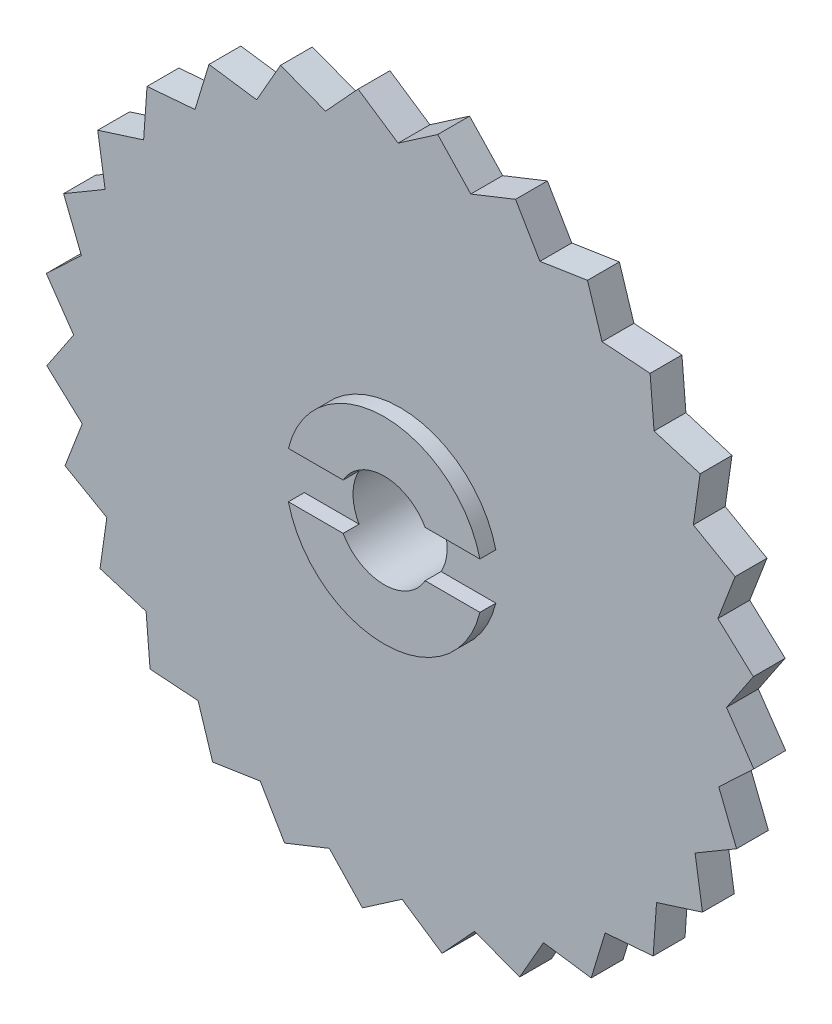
SolidWorks part; units mm, degrees
ref_plane "Plan de face" through (0, 0, 0) normal (0, 0, 1) x (1, 0, 0)
ref_plane "Plan de dessus" through (0, 0, 0) normal (0, 1, 0) x (1, 0, 0)
ref_plane "Plan de droite" through (0, 0, 0) normal (1, 0, 0) x (0, 0, -1)
sketch "Esquisse1" plane through (0, 0, 0) normal (0, 0, 1) x (1, 0, 0)
  circle A0 centre (0, 0) radius 22.34
  dimension "D1" = 44.68
extrude "Extrusion1" add sketch "Esquisse1" along normal blind 9
sketch "Esquisse2" plane through (0, 0, 9) normal (0, 0, 1) x (1, 0, 0)
  circle A0 centre (0, 0) radius 6.185
  circle A1 centre (0, 0) radius 22.34
  dimension "D1" = 12.37
  dimension "D2" = 44.68
extrude "Enlèv. mat.-Extru.1" cut sketch "Esquisse2" against normal blind 1
sketch "Esquisse3" plane through (0, 0, 9) normal (0, 0, 1) x (1, 0, 0)
  circle A0 centre (0, 0) radius 2.955
  dimension "D1" = 5.91
extrude "Enlèv. mat.-Extru.2" cut sketch "Esquisse3" against normal through all
sketch "Esquisse4" plane through (0, 0, 0) normal (0, 0, -1) x (-1, 0, 0)
  circle A0 centre (0, 0) radius 8.5
  circle A1 centre (0, 0) radius 22.34
  dimension "D1" = 17
  dimension "D2" = 44.68
extrude "Enlèv. mat.-Extru.3" cut sketch "Esquisse4" against normal blind 6
sketch "Esquisse5" plane through (0, 0, 0) normal (0, 0, -1) x (-1, 0, 0)
  circle A0 centre (0, 0) radius 6.975
  circle A2 centre (0, 0) radius 8.5
  dimension "D1" = 17
  dimension "D2" = 13.95
extrude "Enlèv. mat.-Extru.4" cut sketch "Esquisse5" against normal blind 1
sketch "Esquisse6" plane through (0, 0, 1) normal (0, 0, -1) x (-1, 0, 0)
  circle A0 centre (0, 0) radius 5.97
  circle A1 centre (0, 0) radius 8.5
  dimension "D1" = 11.94
  dimension "D2" = 17
extrude "Enlèv. mat.-Extru.5" cut sketch "Esquisse6" against normal blind 3.22
sketch "Esquisse7" plane through (0, 0, 4.22) normal (0, 0, -1) x (-1, 0, 0)
  circle A0 centre (0, 0) radius 6.96
  circle A1 centre (0, 0) radius 8.5
  dimension "D1" = 13.92
  dimension "D2" = 17
extrude "Enlèv. mat.-Extru.6" cut sketch "Esquisse7" against normal blind 1.78
sketch "Esquisse9" plane through (0, 0, 8) normal (0, 0, 1) x (1, 0, 0)
  line L0 (-22.184, -2.6357) -> (0, 0) construction
  line L1 (0, 0) -> (-22.2143, 2.3668) construction
  line L2 (0, 0) -> (-22.3396, -0.1353)
  line L3 (-19.3801, -2.3026) -> (-19.3933, -0.1175) construction
  line L4 (-19.3933, -0.1175) -> (-19.4065, 2.0676) construction
  line L5 (-22.184, -2.6357) -> (-20.4996, -0.1242)
  line L6 (-20.4996, -0.1242) -> (-22.2143, 2.3668)
  line L7 (-22.184, -2.6357) -> (-19.958, -4.6827)
  line L8 (-19.958, -4.6827) -> (-21.0413, -7.506)
  line L9 (0, 0) -> (-21.0413, -7.506) construction
  line L10 (-15.9498, -12.8784) -> (-15.7008, -15.8922)
  line L11 (-18.8435, -12) -> (-15.9498, -12.8784)
  line L12 (-18.8435, -12) -> (-18.4156, -9.0063)
  line L13 (-18.4156, -9.0063) -> (-21.0413, -7.506)
  line L14 (0, 0) -> (-15.7008, -15.8922) construction
  line L15 (-12.6842, -16.1047) -> (-15.7008, -15.8922)
  line L16 (-11.7708, -18.9875) -> (-12.6842, -16.1047)
  line L17 (-11.7708, -18.9875) -> (-8.7826, -18.5234)
  line L18 (-8.7826, -18.5234) -> (-7.2506, -21.1307)
  line L19 (-4.4405, -20.0133) -> (-7.2506, -21.1307)
  line L20 (-2.3668, -22.2143) -> (-4.4405, -20.0133)
  line L21 (-2.3668, -22.2143) -> (0.1242, -20.4996)
  line L22 (0.1242, -20.4996) -> (2.6357, -22.184)
  line L23 (0, 0) -> (2.6357, -22.184) construction
  line L24 (4.6827, -19.958) -> (2.6357, -22.184)
  line L25 (7.506, -21.0413) -> (4.6827, -19.958)
  line L26 (7.506, -21.0413) -> (9.0063, -18.4156)
  line L27 (9.0063, -18.4156) -> (12, -18.8435)
  line L28 (12.8784, -15.9498) -> (12, -18.8435)
  line L29 (15.8922, -15.7008) -> (12.8784, -15.9498)
  line L30 (15.8922, -15.7008) -> (16.1047, -12.6842)
  line L31 (16.1047, -12.6842) -> (18.9875, -11.7708)
  line L32 (18.5234, -8.7826) -> (18.9875, -11.7708)
  line L33 (21.1307, -7.2506) -> (18.5234, -8.7826)
  line L34 (21.1307, -7.2506) -> (20.0133, -4.4405)
  line L35 (20.0133, -4.4405) -> (22.2143, -2.3668)
  line L36 (20.4996, 0.1242) -> (22.2143, -2.3668)
  line L37 (22.184, 2.6357) -> (20.4996, 0.1242)
  line L38 (22.184, 2.6357) -> (19.958, 4.6827)
  line L39 (19.958, 4.6827) -> (21.0413, 7.506)
  line L40 (-7.506, 21.0413) -> (-9.0063, 18.4156)
  line L41 (-9.0063, 18.4156) -> (-12, 18.8435)
  line L42 (-12.8784, 15.9498) -> (-12, 18.8435)
  line L43 (-15.8922, 15.7008) -> (-12.8784, 15.9498)
  line L44 (-15.8922, 15.7008) -> (-16.1047, 12.6842)
  line L45 (-16.1047, 12.6842) -> (-18.9875, 11.7708)
  line L46 (-18.5234, 8.7826) -> (-18.9875, 11.7708)
  line L47 (-21.1307, 7.2506) -> (-18.5234, 8.7826)
  line L48 (-21.1307, 7.2506) -> (-20.0133, 4.4405)
  line L49 (-20.0133, 4.4405) -> (-22.2143, 2.3668)
  line L50 (21.0413, 7.506) -> (0, 0) construction
  line L51 (-7.506, 21.0413) -> (-4.6827, 19.958)
  line L52 (-4.6827, 19.958) -> (-2.6357, 22.184)
  line L53 (-0.1242, 20.4996) -> (-2.6357, 22.184)
  line L54 (2.3668, 22.2143) -> (-0.1242, 20.4996)
  line L55 (2.3668, 22.2143) -> (4.4405, 20.0133)
  line L56 (4.4405, 20.0133) -> (7.2506, 21.1307)
  line L57 (8.7826, 18.5234) -> (7.2506, 21.1307)
  line L58 (11.7708, 18.9875) -> (8.7826, 18.5234)
  line L59 (11.7708, 18.9875) -> (12.6842, 16.1047)
  line L60 (12.6842, 16.1047) -> (15.7008, 15.8922)
  line L61 (15.9498, 12.8784) -> (15.7008, 15.8922)
  line L62 (18.8435, 12) -> (15.9498, 12.8784)
  line L63 (18.8435, 12) -> (18.4156, 9.0063)
  line L64 (18.4156, 9.0063) -> (21.0413, 7.506)
  circle A0 centre (0, 0) radius 22.34
  circle A1 centre (0, 0) radius 20.5
  arc A2 (-22.2143, 2.3668) -> (-22.184, -2.6357) centre (-20.4996, -0.1242) ccw
  arc A3 (-21.0413, -7.506) -> (-22.184, -2.6357) centre (-19.958, -4.6827) cw
  arc A4 (-15.7008, -15.8922) -> (-18.8435, -12) centre (-15.9498, -12.8784) cw
  arc A5 (-21.0413, -7.506) -> (-18.8435, -12) centre (-18.4156, -9.0063) ccw
  arc A6 (-15.7008, -15.8922) -> (-11.7708, -18.9875) centre (-12.6842, -16.1047) ccw
  arc A7 (-7.2506, -21.1307) -> (-11.7708, -18.9875) centre (-8.7826, -18.5234) cw
  arc A8 (-7.2506, -21.1307) -> (-2.3668, -22.2143) centre (-4.4405, -20.0133) ccw
  arc A9 (2.6357, -22.184) -> (-2.3668, -22.2143) centre (0.1242, -20.4996) cw
  arc A10 (2.6357, -22.184) -> (7.506, -21.0413) centre (4.6827, -19.958) ccw
  arc A11 (12, -18.8435) -> (7.506, -21.0413) centre (9.0063, -18.4156) cw
  arc A12 (12, -18.8435) -> (15.8922, -15.7008) centre (12.8784, -15.9498) ccw
  arc A13 (18.9875, -11.7708) -> (15.8922, -15.7008) centre (16.1047, -12.6842) cw
  arc A14 (18.9875, -11.7708) -> (21.1307, -7.2506) centre (18.5234, -8.7826) ccw
  arc A15 (22.2143, -2.3668) -> (21.1307, -7.2506) centre (20.0133, -4.4405) cw
  arc A16 (22.2143, -2.3668) -> (22.184, 2.6357) centre (20.4996, 0.1242) ccw
  arc A17 (21.0413, 7.506) -> (22.184, 2.6357) centre (19.958, 4.6827) cw
  arc A18 (-12, 18.8435) -> (-7.506, 21.0413) centre (-9.0063, 18.4156) cw
  arc A19 (-12, 18.8435) -> (-15.8922, 15.7008) centre (-12.8784, 15.9498) ccw
  arc A20 (-18.9875, 11.7708) -> (-15.8922, 15.7008) centre (-16.1047, 12.6842) cw
  arc A21 (-18.9875, 11.7708) -> (-21.1307, 7.2506) centre (-18.5234, 8.7826) ccw
  arc A22 (-22.2143, 2.3668) -> (-21.1307, 7.2506) centre (-20.0133, 4.4405) cw
  arc A23 (-2.6357, 22.184) -> (-7.506, 21.0413) centre (-4.6827, 19.958) ccw
  arc A24 (-2.6357, 22.184) -> (2.3668, 22.2143) centre (-0.1242, 20.4996) cw
  arc A25 (7.2506, 21.1307) -> (2.3668, 22.2143) centre (4.4405, 20.0133) ccw
  arc A26 (7.2506, 21.1307) -> (11.7708, 18.9875) centre (8.7826, 18.5234) cw
  arc A27 (15.7008, 15.8922) -> (11.7708, 18.9875) centre (12.6842, 16.1047) ccw
  arc A28 (15.7008, 15.8922) -> (18.8435, 12) centre (15.9498, 12.8784) cw
  arc A29 (21.0413, 7.506) -> (18.8435, 12) centre (18.4156, 9.0063) ccw
  point P9 (-20.4996, -0.1242)
  dimension "D1" = 44.68
  dimension "D2" = 41
  dimension "D3" = 12.857
  dimension "D4" = 1.84
extrude "Enlèv. mat.-Extru.7" cut sketch "Esquisse9" against normal through all contours L12 L13 M2 | L8 L7 M2 | L2 L6 M2 | L5 L2 M2 | L11 L10 M2 | L16 L15 M2 | L18 L17 M2 | L20 L19 M2 | L22 L21 M2 | L25 L24 M2 | L27 L26 M2 | L29 L28 M2 | L31 L30 M2 | L33 L32 M2 | L35 L34 M2 | L37 L36 M2 | L39 L38 M2 | L63 L64 M2 | L62 L61 M2 | L59 L60 M2 | L55 L56 M2 | L58 L57 M2 | L54 L53 M2 | L51 L52 M2 | L41 L40 M2 | L43 L42 M2 | L47 L46 M2 | L45 L44 M2 | L49 L48 M2
sketch "Esquisse13" plane through (0, 0, 9) normal (0, 0, 1) x (1, 0, 0)
  line L0 (-6.185, 0) -> (6.185, 0) construction
  line L1 (6.185, 0) -> (6.185, 1.45)
  line L2 (6.185, 0) -> (6.185, -1.45)
  line L3 (-6.185, 0) -> (-6.185, 1.45)
  line L4 (-6.185, -1.45) -> (6.185, -1.45)
  line L5 (-6.185, 1.45) -> (6.185, 1.45)
  line L7 (-6.185, 0) -> (-6.185, -1.45)
  circle A0 centre (0, 0) radius 6.185 construction
  dimension "D1" = 1.45
  dimension "D2" = 1.45
extrude "Enlèv. mat.-Extru.14" cut sketch "Esquisse13" against normal blind 1
sketch "Esquisse14" plane through (0, 0, 0) normal (0, 0, -1) x (-1, 0, 0)
  line L0 (-6.975, 0) -> (6.975, 0) construction
  line L1 (6.975, 0) -> (6.975, 1.45)
  line L2 (6.975, 0) -> (6.975, -1.45)
  line L3 (6.975, 1.45) -> (-6.975, 1.45)
  line L4 (-6.975, 1.45) -> (-6.975, -1.45)
  line L5 (-6.975, -1.45) -> (6.975, -1.45)
  circle A0 centre (0, 0) radius 6.975 construction
  dimension "D1" = 1.45
  dimension "D2" = 1.45
extrude "Enlèv. mat.-Extru.15" cut sketch "Esquisse14" against normal blind 0.5
sketch "Esquisse15" plane through (0, 0, 0) normal (1, 0, 0) x (0, 0, -1)
  line L0 (-2.61, 5.97) -> (-2.61, -5.97) construction
  line L1 (-4.22, 5.97) -> (-1, 5.97)
  line L2 (-4.22, 5.97) -> (-4.22, -5.97)
  line L3 (-4.22, -5.97) -> (-1, -5.97)
  line L4 (-1, 5.97) -> (-1, -5.97)
  line L5 (-4.22, 0) -> (-1, 0) construction
  line L6 (-2.61, 1.5) -> (-2.61, -1.5)
  line L7 (-4.11, 0) -> (-1.11, 0)
  circle A0 centre (-2.61, 0) radius 1.5
  dimension "D1" = 3
extrude "Enlèv. mat.-Extru.16" cut sketch "Esquisse15" against normal through all and the other way through all contours A0 L7 L6 | A0 L6 L7 | A0 L7 L6 | A0 L6 L7
